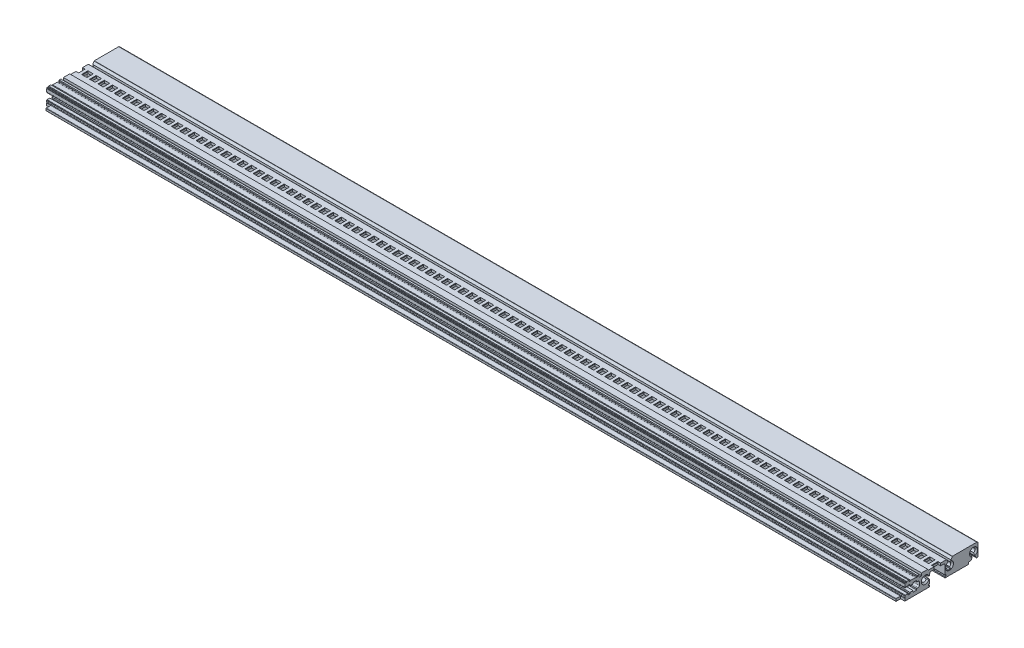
SolidWorks part; units mm, degrees
other "34566284"
ref_plane "前视基准面" through (0, 0, 0) normal (0, 0, 1) x (1, 0, 0)
ref_plane "上视基准面" through (0, 0, 0) normal (0, 1, 0) x (1, 0, 0)
ref_plane "右视基准面" through (0, 0, 0) normal (1, 0, 0) x (0, 0, -1)
imported_body "输入1"
sketch "草图1" plane through (215.9, 0, 0) normal (1, 0, 0) x (0, 0, -1)
  line L1 (-28.3314, 4.2035) -> (32.3445, 4.2035)
  line L2 (-28.3314, 4.2035) -> (-28.3314, -13.155)
  line L3 (-28.3314, -13.155) -> (32.3445, -13.155)
  line L4 (32.3445, 4.2035) -> (32.3445, -13.155)
extrude "切除-拉伸1" cut sketch "草图1" against normal up to vertex
sketch "草图2" plane through (188.8268, 0, 0) normal (1, 0, 0) x (0, 0, -1)
  line L86 (-12.7, -0.3) -> (-13.3, -0.3)
  line L87 (-13.6873, 0) -> (-16.5127, 0)
  line L88 (-16.9, -0.3) -> (-17.5, -0.3)
  line L89 (-17.7, -0.1) -> (-17.7, 0.6)
  line L90 (-17.7, 0.6) -> (-18.95, 0.6)
  line L91 (-19.15, 0.4) -> (-19.15, 0.1)
  line L92 (-19.35, -0.1) -> (-19.45, -0.1)
  line L93 (-19.65, 0.1) -> (-19.65, 0.2)
  line L94 (-19.85, 0.4) -> (-19.95, 0.4)
  line L95 (-20.15, 0.2) -> (-20.15, 0.0328)
  line L96 (-20.2086, -0.1086) -> (-20.25, -0.15)
  line L97 (-20.25, -0.15) -> (-20.25, -1.95)
  line L98 (-20.25, -1.95) -> (-20.2086, -1.9914)
  line L99 (-20.15, -2.1328) -> (-20.15, -2.3)
  line L100 (-19.95, -2.5) -> (-19.85, -2.5)
  line L101 (-19.65, -2.3) -> (-19.65, -2.2)
  line L102 (-19.45, -2) -> (-19.2328, -2)
  line L103 (-19.0914, -2.0586) -> (-18.5086, -2.6414)
  line L104 (-18.3672, -2.7) -> (-18.25, -2.7)
  line L105 (-18.25, -2.7) -> (-18.25, -1.85)
  line L106 (-18.25, -1.85) -> (-17.05, -1.85)
  line L107 (-17.05, -1.85) -> (-17.05, -2.7)
  line L108 (-17.05, -2.7) -> (-15.05, -2.7)
  line L109 (-15.05, -2.7) -> (-15.05, -1.85)
  line L110 (-15.05, -1.85) -> (-12.85, -1.85)
  line L111 (-12.85, -1.85) -> (-12.85, -2.7)
  line L112 (-12.85, -2.7) -> (-12.05, -2.7)
  line L113 (-11.25, -3.5) -> (-11.25, -5.45)
  line L114 (-12.05, -6.25) -> (-12.85, -6.25)
  line L115 (-12.85, -6.25) -> (-12.85, -7.1)
  line L116 (-12.85, -7.1) -> (-15.05, -7.1)
  line L117 (-15.05, -7.1) -> (-15.05, -6.25)
  line L118 (-15.05, -6.25) -> (-17.05, -6.25)
  line L119 (-17.05, -6.25) -> (-17.05, -7.1)
  line L120 (-17.05, -7.1) -> (-18.25, -7.1)
  line L121 (-18.25, -7.1) -> (-18.25, -6.25)
  line L122 (-18.25, -6.25) -> (-19.9587, -6.25)
  line L123 (-20.2086, -6.5086) -> (-20.25, -6.55)
  line L124 (-20.25, -6.55) -> (-20.25, -7.28)
  line L125 (-20.25, -7.28) -> (-20.2086, -7.3214)
  line L126 (-20.15, -7.4628) -> (-20.15, -7.7)
  line L127 (-20.35, -7.9) -> (-23.05, -7.9)
  line L128 (-23.25, -8.1) -> (-23.25, -9.2)
  line L129 (-23.05, -9.4) -> (-4.75, -9.4)
  line L130 (-4.75, -9.4) -> (-4.75, -8.7)
  line L131 (-4.75, -8.7) -> (-5.5, -8.7)
  line L132 (-5.5, -8.7) -> (-5.5, -7.7)
  line L133 (-5.5, -7.7) -> (-4.75, -7.7)
  line L134 (-4.75, -7.7) -> (-4.75, -5.45)
  line L135 (-5.25, -4.95) -> (-6.5, -4.95)
  line L136 (-6.5, -3.45) -> (-5.25, -3.45)
  line L137 (-4.75, -2.95) -> (-4.75, -2.3)
  line L138 (-3.95, -1.5) -> (3.95, -1.5)
  line L139 (4.75, -2.3) -> (4.75, -7.7)
  line L140 (4.75, -7.7) -> (5.5, -7.7)
  line L141 (5.5, -7.7) -> (5.5, -8.7)
  line L142 (5.5, -8.7) -> (4.75, -8.7)
  line L143 (4.75, -8.7) -> (4.75, -9.4)
  line L144 (4.75, -9.4) -> (19.1, -9.4)
  line L145 (19.3, -9.2) -> (19.3, -8.1)
  line L146 (19.3, -8.1) -> (20.7667, -8.1)
  line L147 (20.9399, -8) -> (21.575, -6.9)
  line L148 (21.575, -6.9) -> (21.575, -5.0408)
  line L149 (21.575, -3.3592) -> (21.575, -2.5571)
  line L150 (21.925, -1.7) -> (23.075, -1.7)
  line L151 (23.425, -2.5571) -> (23.425, -3.3592)
  line L152 (23.425, -5.0408) -> (23.425, -6.9)
  line L153 (23.425, -6.9) -> (24.2333, -8.3)
  line L154 (24.4065, -8.4) -> (25.05, -8.4)
  line L155 (25.25, -8.2) -> (25.25, -0.8)
  line L156 (24.45, 0) -> (9.4065, 0)
  line L157 (9.2333, -0.1) -> (8.425, -1.5)
  line L158 (8.425, -1.5) -> (8.425, -3.3592)
  line L159 (8.425, -5.0408) -> (8.425, -6.2)
  line L160 (8.225, -6.4) -> (6.775, -6.4)
  line L161 (6.575, -6.2) -> (6.575, -5.0408)
  line L162 (6.575, -3.3592) -> (6.575, -1.5)
  line L163 (6.575, -1.5) -> (5.7667, -0.1)
  line L164 (5.5935, 0) -> (-5.95, 0)
  line L165 (-5.95, 0) -> (-5.95, 0.6)
  line L166 (-5.95, 0.6) -> (-9.85, 0.6)
  line L167 (-9.85, 0.6) -> (-9.85, -0.8)
  line L168 (-10.05, -1) -> (-11.25, -1)
  line L169 (-11.45, -0.8) -> (-11.45, 0.6)
  line L170 (-11.45, 0.6) -> (-12.5, 0.6)
  line L171 (-12.5, 0.6) -> (-12.5, -0.1)
  line L172 (-12.7, -0.3) -> (-13.3, -0.3)
  line L173 (-13.6873, 0) -> (-16.5127, 0)
  line L174 (-16.9, -0.3) -> (-17.5, -0.3)
  line L175 (-17.7, -0.1) -> (-17.7, 0.6)
  line L176 (-17.7, 0.6) -> (-18.95, 0.6)
  line L177 (-19.15, 0.4) -> (-19.15, 0.1)
  line L178 (-19.35, -0.1) -> (-19.45, -0.1)
  line L179 (-19.65, 0.1) -> (-19.65, 0.2)
  line L180 (-19.85, 0.4) -> (-19.95, 0.4)
  line L181 (-20.15, 0.2) -> (-20.15, 0.0328)
  line L182 (-20.2086, -0.1086) -> (-20.25, -0.15)
  line L183 (-20.25, -0.15) -> (-20.25, -1.95)
  line L184 (-20.25, -1.95) -> (-20.2086, -1.9914)
  line L185 (-20.15, -2.1328) -> (-20.15, -2.3)
  line L186 (-19.95, -2.5) -> (-19.85, -2.5)
  line L187 (-19.65, -2.3) -> (-19.65, -2.2)
  line L188 (-19.45, -2) -> (-19.2328, -2)
  line L189 (-19.0914, -2.0586) -> (-18.5086, -2.6414)
  line L190 (-18.3672, -2.7) -> (-18.25, -2.7)
  line L191 (-18.25, -2.7) -> (-18.25, -1.85)
  line L192 (-18.25, -1.85) -> (-17.05, -1.85)
  line L193 (-17.05, -1.85) -> (-17.05, -2.7)
  line L194 (-17.05, -2.7) -> (-15.05, -2.7)
  line L195 (-15.05, -2.7) -> (-15.05, -1.85)
  line L196 (-15.05, -1.85) -> (-12.85, -1.85)
  line L197 (-12.85, -1.85) -> (-12.85, -2.7)
  line L198 (-12.85, -2.7) -> (-12.05, -2.7)
  line L199 (-11.25, -3.5) -> (-11.25, -5.45)
  line L200 (-12.05, -6.25) -> (-12.85, -6.25)
  line L201 (-12.85, -6.25) -> (-12.85, -7.1)
  line L202 (-12.85, -7.1) -> (-15.05, -7.1)
  line L203 (-15.05, -7.1) -> (-15.05, -6.25)
  line L204 (-15.05, -6.25) -> (-17.05, -6.25)
  line L205 (-17.05, -6.25) -> (-17.05, -7.1)
  line L206 (-17.05, -7.1) -> (-18.25, -7.1)
  line L207 (-18.25, -7.1) -> (-18.25, -6.25)
  line L208 (-18.25, -6.25) -> (-19.9587, -6.25)
  line L209 (-20.2086, -6.5086) -> (-20.25, -6.55)
  line L210 (-20.25, -6.55) -> (-20.25, -7.28)
  line L211 (-20.25, -7.28) -> (-20.2086, -7.3214)
  line L212 (-20.15, -7.4628) -> (-20.15, -7.7)
  line L213 (-20.35, -7.9) -> (-23.05, -7.9)
  line L214 (-23.25, -8.1) -> (-23.25, -9.2)
  line L215 (-23.05, -9.4) -> (-4.75, -9.4)
  line L216 (-4.75, -9.4) -> (-4.75, -8.7)
  line L217 (-4.75, -8.7) -> (-5.5, -8.7)
  line L218 (-5.5, -8.7) -> (-5.5, -7.7)
  line L219 (-5.5, -7.7) -> (-4.75, -7.7)
  line L220 (-4.75, -7.7) -> (-4.75, -5.45)
  line L221 (-5.25, -4.95) -> (-6.5, -4.95)
  line L222 (-6.5, -3.45) -> (-5.25, -3.45)
  line L223 (-4.75, -2.95) -> (-4.75, -2.3)
  line L224 (-3.95, -1.5) -> (3.95, -1.5)
  line L225 (4.75, -2.3) -> (4.75, -7.7)
  line L226 (4.75, -7.7) -> (5.5, -7.7)
  line L227 (5.5, -7.7) -> (5.5, -8.7)
  line L228 (5.5, -8.7) -> (4.75, -8.7)
  line L229 (4.75, -8.7) -> (4.75, -9.4)
  line L230 (4.75, -9.4) -> (19.1, -9.4)
  line L231 (19.3, -9.2) -> (19.3, -8.1)
  line L232 (19.3, -8.1) -> (20.7667, -8.1)
  line L233 (20.9399, -8) -> (21.575, -6.9)
  line L234 (21.575, -6.9) -> (21.575, -5.0408)
  line L235 (21.575, -3.3592) -> (21.575, -2.5571)
  line L236 (21.925, -1.7) -> (23.075, -1.7)
  line L237 (23.425, -2.5571) -> (23.425, -3.3592)
  line L238 (23.425, -5.0408) -> (23.425, -6.9)
  line L239 (23.425, -6.9) -> (24.2333, -8.3)
  line L240 (24.4065, -8.4) -> (25.05, -8.4)
  line L241 (25.25, -8.2) -> (25.25, -0.8)
  line L242 (24.45, 0) -> (9.4065, 0)
  line L243 (9.2333, -0.1) -> (8.425, -1.5)
  line L244 (8.425, -1.5) -> (8.425, -3.3592)
  line L245 (8.425, -5.0408) -> (8.425, -6.2)
  line L246 (8.225, -6.4) -> (6.775, -6.4)
  line L247 (6.575, -6.2) -> (6.575, -5.0408)
  line L248 (6.575, -3.3592) -> (6.575, -1.5)
  line L249 (6.575, -1.5) -> (5.7667, -0.1)
  line L250 (5.5935, 0) -> (-5.95, 0)
  line L251 (-5.95, 0) -> (-5.95, 0.6)
  line L252 (-5.95, 0.6) -> (-9.85, 0.6)
  line L253 (-9.85, 0.6) -> (-9.85, -0.8)
  line L254 (-10.05, -1) -> (-11.25, -1)
  line L255 (-11.45, -0.8) -> (-11.45, 0.6)
  line L256 (-11.45, 0.6) -> (-12.5, 0.6)
  line L257 (-12.5, 0.6) -> (-12.5, -0.1)
  arc A48 (-13.4936, -0.15) -> (-13.3, -0.3) centre (-13.3, -0.1) ccw
  arc A49 (-13.4936, -0.15) -> (-13.6873, 0) centre (-13.6873, -0.2) ccw
  arc A50 (-16.5127, 0) -> (-16.7064, -0.15) centre (-16.5127, -0.2) ccw
  arc A51 (-16.9, -0.3) -> (-16.7064, -0.15) centre (-16.9, -0.1) ccw
  arc A52 (-17.7, -0.1) -> (-17.5, -0.3) centre (-17.5, -0.1) ccw
  arc A53 (-18.95, 0.6) -> (-19.15, 0.4) centre (-18.95, 0.4) ccw
  arc A54 (-19.35, -0.1) -> (-19.15, 0.1) centre (-19.35, 0.1) ccw
  arc A55 (-19.65, 0.1) -> (-19.45, -0.1) centre (-19.45, 0.1) ccw
  arc A56 (-19.65, 0.2) -> (-19.85, 0.4) centre (-19.85, 0.2) ccw
  arc A57 (-19.95, 0.4) -> (-20.15, 0.2) centre (-19.95, 0.2) ccw
  arc A58 (-20.2086, -0.1086) -> (-20.15, 0.0328) centre (-20.35, 0.0328) ccw
  arc A59 (-20.15, -2.1328) -> (-20.2086, -1.9914) centre (-20.35, -2.1328) ccw
  arc A60 (-20.15, -2.3) -> (-19.95, -2.5) centre (-19.95, -2.3) ccw
  arc A61 (-19.85, -2.5) -> (-19.65, -2.3) centre (-19.85, -2.3) ccw
  arc A62 (-19.45, -2) -> (-19.65, -2.2) centre (-19.45, -2.2) ccw
  arc A63 (-19.0914, -2.0586) -> (-19.2328, -2) centre (-19.2328, -2.2) ccw
  arc A64 (-18.5086, -2.6414) -> (-18.3672, -2.7) centre (-18.3672, -2.5) ccw
  arc A65 (-11.25, -3.5) -> (-12.05, -2.7) centre (-12.05, -3.5) ccw
  arc A66 (-12.05, -6.25) -> (-11.25, -5.45) centre (-12.05, -5.45) ccw
  arc A67 (-19.9587, -6.25) -> (-20.1543, -6.4086) centre (-19.9587, -6.45) ccw
  arc A68 (-20.2086, -6.5086) -> (-20.1543, -6.4086) centre (-20.35, -6.3672) ccw
  arc A69 (-20.15, -7.4628) -> (-20.2086, -7.3214) centre (-20.35, -7.4628) ccw
  arc A70 (-20.35, -7.9) -> (-20.15, -7.7) centre (-20.35, -7.7) ccw
  arc A71 (-23.05, -7.9) -> (-23.25, -8.1) centre (-23.05, -8.1) ccw
  arc A72 (-23.25, -9.2) -> (-23.05, -9.4) centre (-23.05, -9.2) ccw
  arc A73 (-4.75, -5.45) -> (-5.25, -4.95) centre (-5.25, -5.45) ccw
  arc A74 (-6.5, -3.45) -> (-6.5, -4.95) centre (-7.5, -4.2) ccw
  arc A75 (-5.25, -3.45) -> (-4.75, -2.95) centre (-5.25, -2.95) ccw
  arc A76 (-3.95, -1.5) -> (-4.75, -2.3) centre (-3.95, -2.3) ccw
  arc A77 (4.75, -2.3) -> (3.95, -1.5) centre (3.95, -2.3) ccw
  arc A78 (19.1, -9.4) -> (19.3, -9.2) centre (19.1, -9.2) ccw
  arc A79 (20.7667, -8.1) -> (20.9399, -8) centre (20.7667, -7.9) ccw
  arc A80 (21.575, -3.3592) -> (21.575, -5.0408) centre (22.5, -4.2) ccw
  arc A81 (21.925, -1.7) -> (21.575, -2.5571) centre (21.925, -2.2) ccw
  arc A82 (23.425, -2.5571) -> (23.075, -1.7) centre (23.075, -2.2) ccw
  arc A83 (23.425, -5.0408) -> (23.425, -3.3592) centre (22.5, -4.2) ccw
  arc A84 (24.2333, -8.3) -> (24.4065, -8.4) centre (24.4065, -8.2) ccw
  arc A85 (25.05, -8.4) -> (25.25, -8.2) centre (25.05, -8.2) ccw
  arc A86 (25.25, -0.8) -> (24.45, 0) centre (24.45, -0.8) ccw
  arc A87 (9.4065, 0) -> (9.2333, -0.1) centre (9.4065, -0.2) ccw
  arc A88 (8.425, -5.0408) -> (8.425, -3.3592) centre (7.5, -4.2) ccw
  arc A89 (8.225, -6.4) -> (8.425, -6.2) centre (8.225, -6.2) ccw
  arc A90 (6.575, -6.2) -> (6.775, -6.4) centre (6.775, -6.2) ccw
  arc A91 (6.575, -3.3592) -> (6.575, -5.0408) centre (7.5, -4.2) ccw
  arc A92 (5.7667, -0.1) -> (5.5935, 0) centre (5.5935, -0.2) ccw
  arc A93 (-10.05, -1) -> (-9.85, -0.8) centre (-10.05, -0.8) ccw
  arc A94 (-11.45, -0.8) -> (-11.25, -1) centre (-11.25, -0.8) ccw
  arc A95 (-12.7, -0.3) -> (-12.5, -0.1) centre (-12.7, -0.1) ccw
  arc A96 (-13.4936, -0.15) -> (-13.3, -0.3) centre (-13.3, -0.1) ccw
  arc A97 (-13.4936, -0.15) -> (-13.6873, 0) centre (-13.6873, -0.2) ccw
  arc A98 (-16.5127, 0) -> (-16.7064, -0.15) centre (-16.5127, -0.2) ccw
  arc A99 (-16.9, -0.3) -> (-16.7064, -0.15) centre (-16.9, -0.1) ccw
  arc A100 (-17.7, -0.1) -> (-17.5, -0.3) centre (-17.5, -0.1) ccw
  arc A101 (-18.95, 0.6) -> (-19.15, 0.4) centre (-18.95, 0.4) ccw
  arc A102 (-19.35, -0.1) -> (-19.15, 0.1) centre (-19.35, 0.1) ccw
  arc A103 (-19.65, 0.1) -> (-19.45, -0.1) centre (-19.45, 0.1) ccw
  arc A104 (-19.65, 0.2) -> (-19.85, 0.4) centre (-19.85, 0.2) ccw
  arc A105 (-19.95, 0.4) -> (-20.15, 0.2) centre (-19.95, 0.2) ccw
  arc A106 (-20.2086, -0.1086) -> (-20.15, 0.0328) centre (-20.35, 0.0328) ccw
  arc A107 (-20.15, -2.1328) -> (-20.2086, -1.9914) centre (-20.35, -2.1328) ccw
  arc A108 (-20.15, -2.3) -> (-19.95, -2.5) centre (-19.95, -2.3) ccw
  arc A109 (-19.85, -2.5) -> (-19.65, -2.3) centre (-19.85, -2.3) ccw
  arc A110 (-19.45, -2) -> (-19.65, -2.2) centre (-19.45, -2.2) ccw
  arc A111 (-19.0914, -2.0586) -> (-19.2328, -2) centre (-19.2328, -2.2) ccw
  arc A112 (-18.5086, -2.6414) -> (-18.3672, -2.7) centre (-18.3672, -2.5) ccw
  arc A113 (-11.25, -3.5) -> (-12.05, -2.7) centre (-12.05, -3.5) ccw
  arc A114 (-12.05, -6.25) -> (-11.25, -5.45) centre (-12.05, -5.45) ccw
  arc A115 (-19.9587, -6.25) -> (-20.1543, -6.4086) centre (-19.9587, -6.45) ccw
  arc A116 (-20.2086, -6.5086) -> (-20.1543, -6.4086) centre (-20.35, -6.3672) ccw
  arc A117 (-20.15, -7.4628) -> (-20.2086, -7.3214) centre (-20.35, -7.4628) ccw
  arc A118 (-20.35, -7.9) -> (-20.15, -7.7) centre (-20.35, -7.7) ccw
  arc A119 (-23.05, -7.9) -> (-23.25, -8.1) centre (-23.05, -8.1) ccw
  arc A120 (-23.25, -9.2) -> (-23.05, -9.4) centre (-23.05, -9.2) ccw
  arc A121 (-4.75, -5.45) -> (-5.25, -4.95) centre (-5.25, -5.45) ccw
  arc A122 (-6.5, -3.45) -> (-6.5, -4.95) centre (-7.5, -4.2) ccw
  arc A123 (-5.25, -3.45) -> (-4.75, -2.95) centre (-5.25, -2.95) ccw
  arc A124 (-3.95, -1.5) -> (-4.75, -2.3) centre (-3.95, -2.3) ccw
  arc A125 (4.75, -2.3) -> (3.95, -1.5) centre (3.95, -2.3) ccw
  arc A126 (19.1, -9.4) -> (19.3, -9.2) centre (19.1, -9.2) ccw
  arc A127 (20.7667, -8.1) -> (20.9399, -8) centre (20.7667, -7.9) ccw
  arc A128 (21.575, -3.3592) -> (21.575, -5.0408) centre (22.5, -4.2) ccw
  arc A129 (21.925, -1.7) -> (21.575, -2.5571) centre (21.925, -2.2) ccw
  arc A130 (23.425, -2.5571) -> (23.075, -1.7) centre (23.075, -2.2) ccw
  arc A131 (23.425, -5.0408) -> (23.425, -3.3592) centre (22.5, -4.2) ccw
  arc A132 (24.2333, -8.3) -> (24.4065, -8.4) centre (24.4065, -8.2) ccw
  arc A133 (25.05, -8.4) -> (25.25, -8.2) centre (25.05, -8.2) ccw
  arc A134 (25.25, -0.8) -> (24.45, 0) centre (24.45, -0.8) ccw
  arc A135 (9.4065, 0) -> (9.2333, -0.1) centre (9.4065, -0.2) ccw
  arc A136 (8.425, -5.0408) -> (8.425, -3.3592) centre (7.5, -4.2) ccw
  arc A137 (8.225, -6.4) -> (8.425, -6.2) centre (8.225, -6.2) ccw
  arc A138 (6.575, -6.2) -> (6.775, -6.4) centre (6.775, -6.2) ccw
  arc A139 (6.575, -3.3592) -> (6.575, -5.0408) centre (7.5, -4.2) ccw
  arc A140 (5.7667, -0.1) -> (5.5935, 0) centre (5.5935, -0.2) ccw
  arc A141 (-10.05, -1) -> (-9.85, -0.8) centre (-10.05, -0.8) ccw
  arc A142 (-11.45, -0.8) -> (-11.25, -1) centre (-11.25, -0.8) ccw
  arc A143 (-12.7, -0.3) -> (-12.5, -0.1) centre (-12.7, -0.1) ccw
  dimension "D1" = 0
extrude "凸台-拉伸1" add sketch "草图2" along normal blind 128.67
sketch "草图3" plane through (317.4968, 0, 0) normal (1, 0, 0) x (0, 0, -1)
  circle A0 centre (-7.5, -4.2) radius 1.65
  circle A1 centre (7.5, -4.2) radius 1.65
  circle A2 centre (22.5, -4.2) radius 1.65
extrude "切除-拉伸2" cut sketch "草图3" against normal blind 15.02
chamfer "倒角1" distance 0.85 angle 45 4 edges at (317.4968, -4.2, 9.15) (317.4968, -4.2, -9.15) (317.4968, -4.2, -24.15) (317.4968, -4.2, -20.85)
sketch "草图4" plane through (0, 0, 0) normal (0, 1, 0) x (1, 0, 0)
  line L0 (186.92, 2) -> (186.92, -2) construction
  line L1 (189, 2) -> (192, 2)
  line L2 (189, 2) -> (189, -2)
  line L3 (189, -2) -> (192, -2)
  line L4 (192, 2) -> (192, -2)
  line L5 (194.08, -2) -> (197.08, -2)
  line L6 (197.08, 2) -> (197.08, -2)
  line L7 (194.08, 2) -> (197.08, 2)
  line L8 (194.08, 2) -> (194.08, -2)
  line L9 (199.16, -2) -> (202.16, -2)
  line L10 (202.16, 2) -> (202.16, -2)
  line L11 (199.16, 2) -> (202.16, 2)
  line L12 (199.16, 2) -> (199.16, -2)
  line L13 (204.24, -2) -> (207.24, -2)
  line L14 (207.24, 2) -> (207.24, -2)
  line L15 (204.24, 2) -> (207.24, 2)
  line L16 (204.24, 2) -> (204.24, -2)
  line L17 (209.32, -2) -> (212.32, -2)
  line L18 (212.32, 2) -> (212.32, -2)
  line L19 (209.32, 2) -> (212.32, 2)
  line L20 (209.32, 2) -> (209.32, -2)
  line L21 (214.4, -2) -> (217.4, -2)
  line L22 (217.4, 2) -> (217.4, -2)
  line L23 (214.4, 2) -> (217.4, 2)
  line L24 (214.4, 2) -> (214.4, -2)
  line L25 (219.48, -2) -> (222.48, -2)
  line L26 (222.48, 2) -> (222.48, -2)
  line L27 (219.48, 2) -> (222.48, 2)
  line L28 (219.48, 2) -> (219.48, -2)
  line L29 (224.56, -2) -> (227.56, -2)
  line L30 (227.56, 2) -> (227.56, -2)
  line L31 (224.56, 2) -> (227.56, 2)
  line L32 (224.56, 2) -> (224.56, -2)
  line L33 (229.64, -2) -> (232.64, -2)
  line L34 (232.64, 2) -> (232.64, -2)
  line L35 (229.64, 2) -> (232.64, 2)
  line L36 (229.64, 2) -> (229.64, -2)
  line L37 (234.72, -2) -> (237.72, -2)
  line L38 (237.72, 2) -> (237.72, -2)
  line L39 (234.72, 2) -> (237.72, 2)
  line L40 (234.72, 2) -> (234.72, -2)
  line L41 (239.8, -2) -> (242.8, -2)
  line L42 (242.8, 2) -> (242.8, -2)
  line L43 (239.8, 2) -> (242.8, 2)
  line L44 (239.8, 2) -> (239.8, -2)
  line L45 (244.88, -2) -> (247.88, -2)
  line L46 (247.88, 2) -> (247.88, -2)
  line L47 (244.88, 2) -> (247.88, 2)
  line L48 (244.88, 2) -> (244.88, -2)
  line L49 (249.96, -2) -> (252.96, -2)
  line L50 (252.96, 2) -> (252.96, -2)
  line L51 (249.96, 2) -> (252.96, 2)
  line L52 (249.96, 2) -> (249.96, -2)
  line L53 (255.04, -2) -> (258.04, -2)
  line L54 (258.04, 2) -> (258.04, -2)
  line L55 (255.04, 2) -> (258.04, 2)
  line L56 (255.04, 2) -> (255.04, -2)
  line L57 (260.12, -2) -> (263.12, -2)
  line L58 (263.12, 2) -> (263.12, -2)
  line L59 (260.12, 2) -> (263.12, 2)
  line L60 (260.12, 2) -> (260.12, -2)
  line L61 (265.2, -2) -> (268.2, -2)
  line L62 (268.2, 2) -> (268.2, -2)
  line L63 (265.2, 2) -> (268.2, 2)
  line L64 (265.2, 2) -> (265.2, -2)
  line L65 (270.28, -2) -> (273.28, -2)
  line L66 (273.28, 2) -> (273.28, -2)
  line L67 (270.28, 2) -> (273.28, 2)
  line L68 (270.28, 2) -> (270.28, -2)
  line L69 (275.36, -2) -> (278.36, -2)
  line L70 (278.36, 2) -> (278.36, -2)
  line L71 (275.36, 2) -> (278.36, 2)
  line L72 (275.36, 2) -> (275.36, -2)
  line L73 (280.44, -2) -> (283.44, -2)
  line L74 (283.44, 2) -> (283.44, -2)
  line L75 (280.44, 2) -> (283.44, 2)
  line L76 (280.44, 2) -> (280.44, -2)
  line L77 (285.52, -2) -> (288.52, -2)
  line L78 (288.52, 2) -> (288.52, -2)
  line L79 (285.52, 2) -> (288.52, 2)
  line L80 (285.52, 2) -> (285.52, -2)
  line L81 (290.6, -2) -> (293.6, -2)
  line L82 (293.6, 2) -> (293.6, -2)
  line L83 (290.6, 2) -> (293.6, 2)
  line L84 (290.6, 2) -> (290.6, -2)
  line L85 (295.68, -2) -> (298.68, -2)
  line L86 (298.68, 2) -> (298.68, -2)
  line L87 (295.68, 2) -> (298.68, 2)
  line L88 (295.68, 2) -> (295.68, -2)
  line L89 (300.76, -2) -> (303.76, -2)
  line L90 (303.76, 2) -> (303.76, -2)
  line L91 (300.76, 2) -> (303.76, 2)
  line L92 (300.76, 2) -> (300.76, -2)
  line L93 (305.84, -2) -> (308.84, -2)
  line L94 (308.84, 2) -> (308.84, -2)
  line L95 (305.84, 2) -> (308.84, 2)
  line L96 (305.84, 2) -> (305.84, -2)
  line L97 (310.92, -2) -> (313.92, -2)
  line L98 (313.92, 2) -> (313.92, -2)
  line L99 (310.92, 2) -> (313.92, 2)
  line L100 (310.92, 2) -> (310.92, -2)
  line L101 (316, -2) -> (319, -2)
  line L102 (319, 2) -> (319, -2)
  line L103 (316, 2) -> (319, 2)
  line L104 (316, 2) -> (316, -2)
  dimension "D1" = 3
  dimension "D2" = 5.08
  dimension "D3" = 26
extrude "切除-拉伸3" cut sketch "草图4" against normal through all
sketch "草图5" plane through (0, 0, -2) normal (0, 0, 1) x (1, 0, 0)
  line L0 (189, 0) -> (188.83, 0)
  line L1 (188.83, 0) -> (189, -0.3)
  line L2 (189, -1.5) -> (189, 0) construction
  line L3 (189, -0.3) -> (189, 0)
  line L4 (192, 0) -> (192.17, 0)
  line L5 (192.17, 0) -> (192, -0.3)
  line L6 (192, -1.5) -> (192, 0) construction
  line L7 (192, -0.3) -> (192, 0)
  dimension "D1" = 0.17
  dimension "D2" = 0.3
  dimension "D3" = 0.3
  dimension "D4" = 0.17
extrude "切除-拉伸4" cut sketch "草图5" along normal up to surface (4 mm away)
pattern_linear "阵列(线性)1" count 25 spacing 5.08 along (1, 0, 0) of "切除-拉伸4"
chamfer "倒角2" distance 0.17 distance2 0.3 1 edges at (316, 0, 0)
sketch "草图6" plane through (0, -7.9, 0) normal (0, 1, 0) x (1, 0, 0)
  line L1 (317.4968, -23.25) -> (314.8968, -23.25)
  line L2 (317.4968, -23.25) -> (317.4968, -20.25)
  line L3 (317.4968, -20.25) -> (314.8968, -20.25)
  line L4 (314.8968, -23.25) -> (314.8968, -20.25)
  dimension "D1" = 2.6
  dimension "D2" = 3
extrude "切除-拉伸5" cut sketch "草图6" against normal mid plane 10
